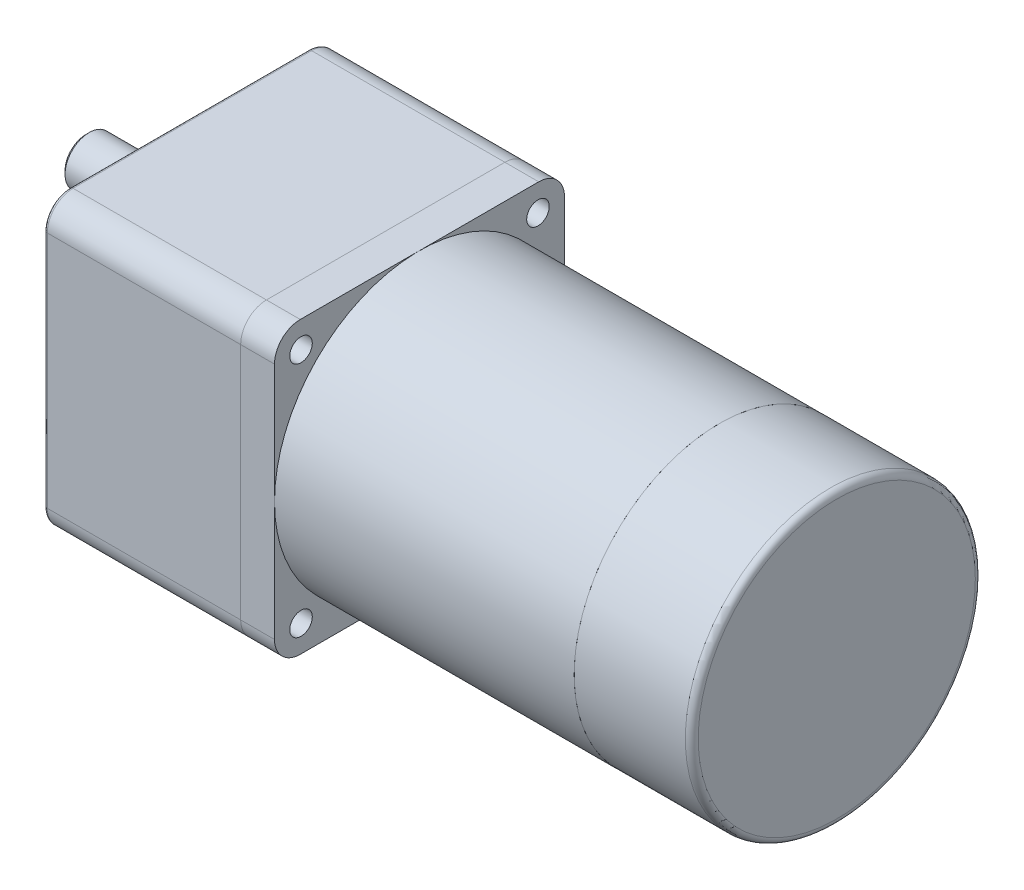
SolidWorks part; units mm, degrees
ref_plane "前视基准面" through (0, 0, 0) normal (0, 0, 1) x (1, 0, 0)
ref_plane "上视基准面" through (0, 0, 0) normal (0, 1, 0) x (1, 0, 0)
ref_plane "右视基准面" through (0, 0, 0) normal (1, 0, 0) x (0, 0, -1)
sketch "草图1" plane through (0, 0, 0) normal (1, 0, 0) x (0, 0, -1)
  line L1 (-37, -45) -> (37, -45)
  line L2 (-45, -37) -> (-45, 37)
  line L3 (-37, 45) -> (37, 45)
  line L4 (45, -37) -> (45, 37)
  line L5 (-45, -45) -> (45, 45) construction
  line L6 (-45, 45) -> (45, -45) construction
  arc A0 (-37, -45) -> (-45, -37) centre (-37, -37) cw
  arc A1 (37, -45) -> (45, -37) centre (37, -37) ccw
  arc A2 (37, 45) -> (45, 37) centre (37, 37) cw
  arc A3 (-45, 37) -> (-37, 45) centre (-37, 37) cw
  point P0 (0, 0)
  dimension "D1" = 8
extrude "凸台-拉伸1" add sketch "草图1" along normal blind 61
sketch "草图2" plane through (61, 0, 0) normal (1, 0, 0) x (0, 0, -1)
  line L0 (37, 45) -> (-37, 45) construction
  line L1 (-37, -45) -> (37, -45)
  line L2 (-45, -37) -> (-45, 37)
  line L3 (-37, 45) -> (37, 45)
  line L4 (45, -37) -> (45, 37)
  line L5 (-45, -45) -> (45, 45) construction
  line L6 (-45, 45) -> (45, -45) construction
  arc A0 (37, 45) -> (45, 37) centre (37, 37) cw
  arc A1 (37, -45) -> (45, -37) centre (37, -37) ccw
  arc A2 (-37, -45) -> (-45, -37) centre (-37, -37) cw
  arc A3 (-45, 37) -> (-37, 45) centre (-37, 37) cw
  point P0 (0, 0)
  dimension "D1" = 8
extrude "凸台-拉伸2" add sketch "草图2" along normal blind 10.5 separate body
fillet "圆角1" radius 1 8 edges at (0, -45, 0) (0, -42.6569, -42.6569) (0, 0, -45) (0, 42.6569, -42.6569) (0, 45, 0) (0, 42.6569, 42.6569) (0, 0, 45) (0, -42.6569, 42.6569)
sketch "草图6" plane through (0, 0, 0) normal (-1, 0, 0) x (0, 0, 1)
  circle A0 centre (0, 18) radius 16
extrude "凸台-拉伸5" add sketch "草图6" along normal blind 3 separate body
fillet "圆角3" radius 0.5 1 edges at (-3, 18, 16)
sketch "草图7" plane through (-3, 0, 0) normal (-1, 0, 0) x (0, 0, 1)
  circle A0 centre (0, 18) radius 7.5
extrude "凸台-拉伸6" add sketch "草图7" along normal blind 29 separate body
ref_plane "基准面1" through (0, 0, -7.5) normal (0, 0, 1) x (1, 0, 0)
sketch "草图8" plane through (0, 0, -7.5) normal (0, 0, 1) x (1, 0, 0)
  line L1 (-32, 25.5) -> (-32, 10.5) construction
  line L2 (-9.5, 20.5) -> (-32, 20.5)
  line L3 (-32, 20.5) -> (-32, 15.5)
  line L4 (-32, 15.5) -> (-9.5, 15.5)
  arc A0 (-9.5, 15.5) -> (-9.5, 20.5) centre (-9.5, 18) ccw
extrude "切除-拉伸2" cut sketch "草图8" along normal blind 3
chamfer "倒角2" distance 1 angle 45 1 edges at (-32, 18, 7.5)
sketch "草图9" plane through (0, 0, 0) normal (-1, 0, 0) x (0, 0, 1)
  circle A0 centre (0, 0) radius 41.4
extrude "切除-拉伸3" cut sketch "草图9" against normal blind 0.5
fillet "圆角4" radius 0.5 1 edges at (0, 0, 41.4)
sketch "草图10" plane through (0, 0, 0) normal (-1, 0, 0) x (0, 0, 1)
  point P19 (-36.7696, 36.7696)
  point P20 (36.7696, 36.7696)
  point P21 (36.7696, -36.7696)
  point P22 (-36.7696, -36.7696)
hole_wizard "M6 螺纹孔1" positions "3D草图1" profile "草图11" tap size "M6" standard "GB"
sketch3d "3D草图1"
  point P0 (0, 36.7696, -36.7696)
  point P3 (0, 36.7696, 36.7696)
  point P6 (0, -36.7696, 36.7696)
  point P9 (0, -36.7696, -36.7696)
sketch "草图11" plane through (0, 36.7696, -36.7696) normal (0, 1, 0) x (0, 0, 1)
  line L0 (0, 0) -> (0, 18.5022)
  line L1 (0, 18.5022) -> (2.5, 17)
  line L2 (2.5, 17) -> (2.5, 0)
  line L5 (2.5, 0) -> (0, 0)
  line L10 (0, 18.5022) -> (-2.5, 17) construction
  line L11 (0, -6.35) -> (0, 107.95) construction
  dimension "螺纹孔钻头直径" = 5
  dimension "螺纹孔钻头深度" = 17
  dimension "导头角度" = 118
sketch "草图13" plane through (71.5, 0, 0) normal (1, 0, 0) x (0, 0, -1)
  circle A0 centre (-36.7696, 36.7696) radius 3.5
  circle A1 centre (36.7696, 36.7696) radius 3.5
  circle A2 centre (36.7696, -36.7696) radius 3.5
  circle A3 centre (-36.7696, -36.7696) radius 3.5
extrude "切除-拉伸4" cut sketch "草图13" against normal blind 62
fillet "圆角5" radius 1 4 edges at (0, -36.7696, -34.2696) (0, -36.7696, 39.2696) (0, 36.7696, 39.2696) (0, 36.7696, -34.2696)
sketch "草图14" plane through (71.5, 0, 0) normal (1, 0, 0) x (0, 0, -1)
  circle A0 centre (0, 0) radius 45
extrude "凸台-拉伸7" add sketch "草图14" along normal blind 93 separate body
sketch "草图15" plane through (164.5, 0, 0) normal (1, 0, 0) x (0, 0, -1)
  circle A0 centre (0, 0) radius 45
extrude "凸台-拉伸8" add sketch "草图15" along normal blind 36.5 separate body
fillet "圆角6" radius 2 1 edges at (201, 0, -45)
